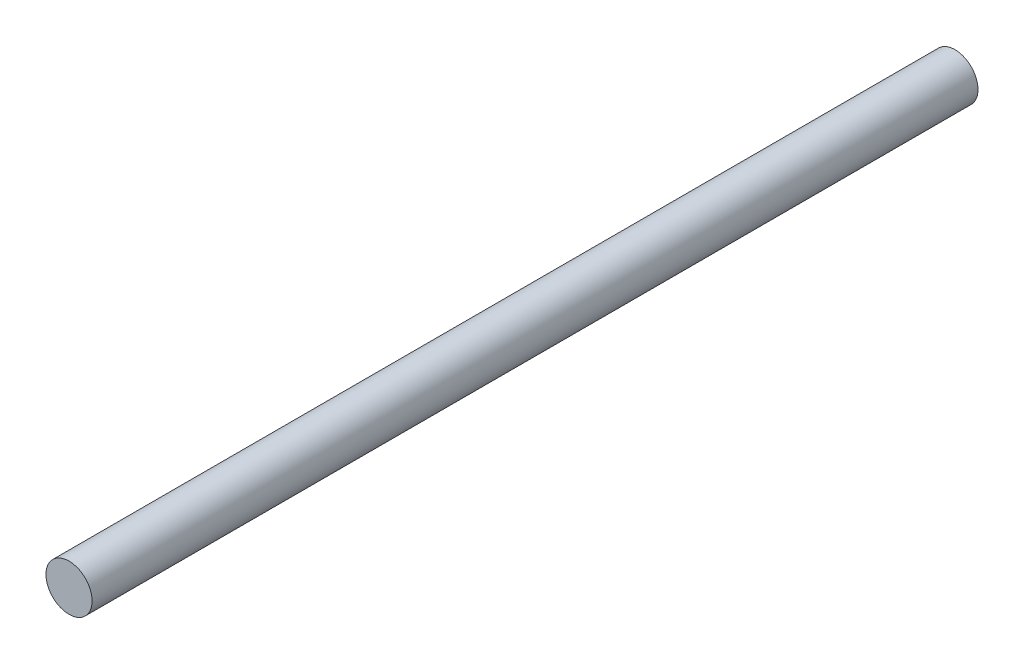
SolidWorks part; units mm, degrees
ref_plane "Face" through (0, 0, 0) normal (0, 0, 1) x (1, 0, 0)
ref_plane "Dessus" through (0, 0, 0) normal (0, 1, 0) x (1, 0, 0)
ref_plane "Droite" through (0, 0, 0) normal (1, 0, 0) x (0, 0, -1)
sketch "Esquisse1" plane through (0, 0, 0) normal (0, 0, 1) x (1, 0, 0)
  circle A0 centre (0, 0) radius 2.5
  dimension "D1" = 5
extrude "Extrusion1" add sketch "Esquisse1" along normal blind 96
